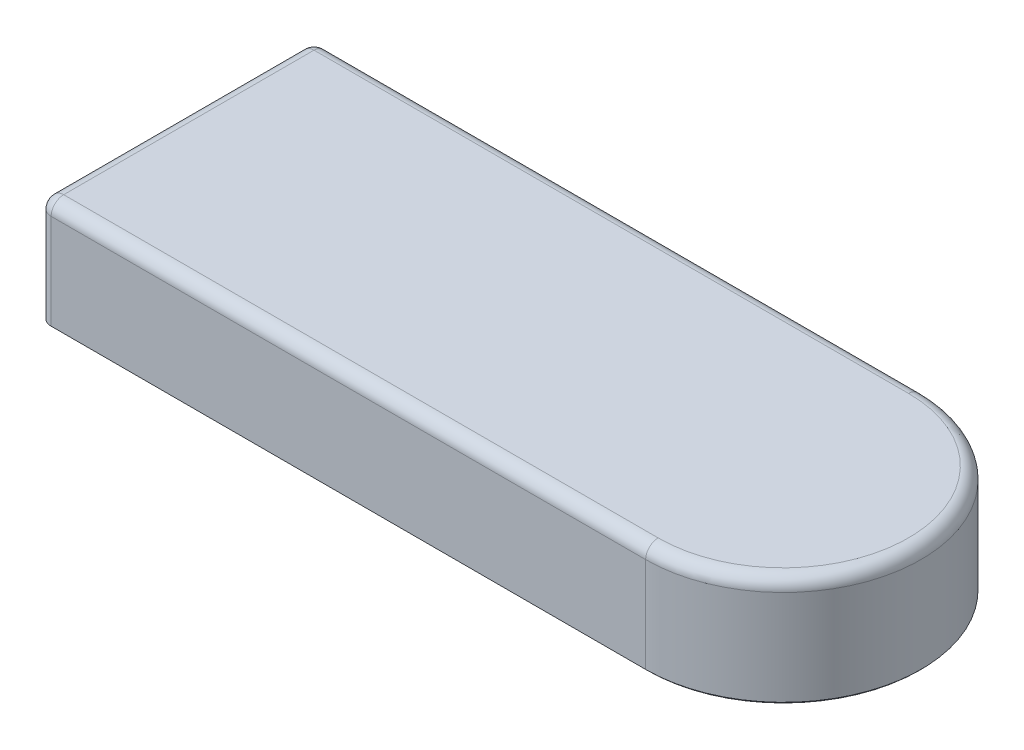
SolidWorks part; units mm, degrees
other "DetailItem1"
other "Aluflex AB"
ref_plane "Front Plane" through (0, 0, 0) normal (0, 0, 1) x (1, 0, 0)
ref_plane "Top Plane" through (0, 0, 0) normal (0, 1, 0) x (1, 0, 0)
ref_plane "Right Plane" through (0, 0, 0) normal (1, 0, 0) x (0, 0, -1)
other "Configuration Table"
sketch "Sketch1" plane through (0, 0, 0) normal (0, 1, 0) x (1, 0, 0)
  line L0 (0, 2) -> (0, 42)
  line L1 (2, 44) -> (97, 44)
  line L2 (2, 0) -> (97, 0)
  arc A0 (97, 44) -> (97, 0) centre (97, 22) cw
  arc A1 (2, 0) -> (0, 2) centre (2, 2) cw
  arc A2 (0, 42) -> (2, 44) centre (2, 42) cw
  point P8 (0, 0)
  point P11 (0, 44)
  dimension "D3" = 2
  dimension "D1" = 44
  dimension "D2" = 97
extrude "Boss-Extrude1" add sketch "Sketch1" along normal blind 17.5
fillet "Fillet1" radius 2 6 edges at (49.5, 17.5, 0) (0.5858, 17.5, -0.5858) (0, 17.5, -22) (0.5858, 17.5, -43.4142) (49.5, 17.5, -44) (119, 17.5, -22)
chamfer "Chamfer1" distance 0.3 angle 45 6 edges at (49.5, 0, -44) (0.5858, 0, -43.4142) (0, 0, -22) (0.5858, 0, -0.5858) (49.5, 0, 0) (119, 0, -22)
equation "\"D1@Boss-Extrude1\"= 17.5"
